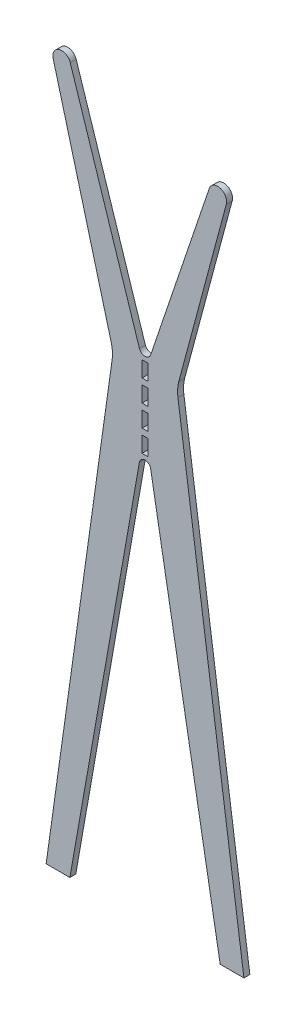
SolidWorks part; units mm, degrees
ref_plane "Alzado" through (0, 0, 0) normal (0, 0, 1) x (1, 0, 0)
ref_plane "Planta" through (0, 0, 0) normal (0, 1, 0) x (1, 0, 0)
ref_plane "Vista lateral" through (0, 0, 0) normal (1, 0, 0) x (0, 0, -1)
sketch "Croquis1" plane through (0, 0, 0) normal (0, 0, 1) x (1, 0, 0)
  line L0 (0, 0) -> (17417.9808, 0) construction
  line L1 (0, 0) -> (0, 17417.9808) construction
  line L2 (-250, -900) -> (-190, -900)
  line L9 (-250, 900) -> (250, 900) construction
  line L10 (-250, 900) -> (-250, -900) construction
  line L11 (-250, -900) -> (250, -900) construction
  line L12 (250, 900) -> (250, -900) construction
  line L13 (-250, 900) -> (250, -900) construction
  line L14 (-250, -900) -> (250, 900) construction
  line L15 (-190, -900) -> (-14.2107, 96.9508)
  line L16 (-250, -900) -> (-83.1114, 287.4744)
  line L17 (-85.3022, 323.2937) -> (-232.2383, 871.6669)
  line L18 (-189.0914, 884.4476) -> (-14.2107, 346.22)
  line L19 (250, -900) -> (190, -900)
  line L20 (250, -900) -> (83.1114, 287.4744)
  line L21 (190, -900) -> (14.2107, 96.9508)
  line L22 (14.2107, 346.22) -> (162.3707, 784.6948)
  line L23 (85.3022, 323.2937) -> (205.4421, 771.662)
  line L24 (183.6976, 800) -> (222.2222, 800) construction
  line L25 (7.5, 229.9484) -> (7.5, 214.9484) construction
  line L26 (-7.5, 324.9484) -> (7.5, 324.9484)
  line L27 (-7.5, 324.9484) -> (-7.5, 284.9484)
  line L28 (-7.5, 284.9484) -> (7.5, 284.9484)
  line L29 (7.5, 324.9484) -> (7.5, 284.9484)
  line L30 (-7.5, 324.9484) -> (7.5, 284.9484) construction
  line L31 (-7.5, 284.9484) -> (7.5, 324.9484) construction
  line L32 (-7.5, 269.9484) -> (7.5, 269.9484)
  line L33 (-7.5, 269.9484) -> (-7.5, 229.9484)
  line L34 (-7.5, 229.9484) -> (7.5, 229.9484)
  line L35 (7.5, 269.9484) -> (7.5, 229.9484)
  line L36 (-7.5, 269.9484) -> (7.5, 229.9484) construction
  line L37 (-7.5, 229.9484) -> (7.5, 269.9484) construction
  line L38 (-7.5, 214.9484) -> (7.5, 214.9484)
  line L39 (-7.5, 214.9484) -> (-7.5, 174.9484)
  line L40 (-7.5, 174.9484) -> (7.5, 174.9484)
  line L41 (7.5, 214.9484) -> (7.5, 174.9484)
  line L42 (-7.5, 214.9484) -> (7.5, 174.9484) construction
  line L43 (-7.5, 174.9484) -> (7.5, 214.9484) construction
  line L44 (-7.5, 159.9484) -> (7.5, 159.9484)
  line L45 (-7.5, 159.9484) -> (-7.5, 119.9484)
  line L46 (-7.5, 119.9484) -> (7.5, 119.9484)
  line L47 (7.5, 159.9484) -> (7.5, 119.9484)
  line L48 (-7.5, 159.9484) -> (7.5, 119.9484) construction
  line L49 (-7.5, 119.9484) -> (7.5, 159.9484) construction
  line L50 (-40, 336.0217) -> (40, 336.0217) construction
  line L51 (-40, 336.0217) -> (-40, 108.875) construction
  line L52 (-40, 108.875) -> (40, 108.875) construction
  line L53 (40, 336.0217) -> (40, 108.875) construction
  line L54 (7.5, 222.4484) -> (40, 222.4484) construction
  arc A0 (-83.1114, 287.4744) -> (-85.3022, 323.2937) centre (-172.2355, 300) ccw
  arc A1 (-232.2383, 871.6669) -> (-189.0914, 884.4476) centre (-210.4975, 877.4923) cw
  arc A2 (83.1114, 287.4744) -> (85.3022, 323.2937) centre (172.2355, 300) cw
  arc A3 (162.3707, 784.6948) -> (205.4421, 771.662) centre (183.6976, 777.4885) cw
  arc A4 (-14.2107, 346.22) -> (14.2107, 346.22) centre (0, 351.0217) ccw
  arc A5 (-14.2107, 96.9508) -> (14.2107, 96.9508) centre (0, 94.4451) cw
  point P5 (0, 0)
  point P23 (0, 249.9484)
  point P33 (0, 304.9484)
  point P42 (0, 194.9484)
  point P47 (0, 139.9484)
  point P56 (0, 336.0217)
extrude "Saliente-Extruir1" add sketch "Croquis1" along normal mid plane 15 contours L17 A1 L18 A4 L22 A3 L23 A2 L20 L19 L21 A5 L15 L2 L16 A0
equation "\"Thickness\"= 15"
equation "\"D1@Saliente-Extruir1\"=\"Thickness\""
equation "\"D14@Croquis1\"=\"Thickness\""
